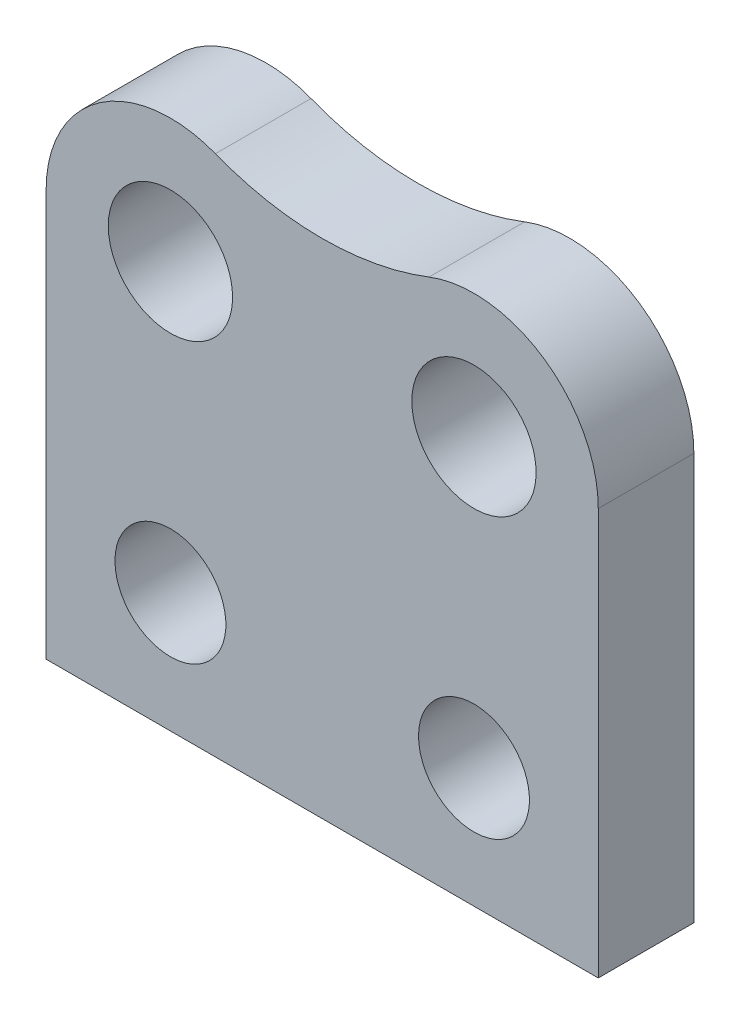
SolidWorks part; units mm, degrees
ref_plane "Front Plane" through (0, 0, 0) normal (0, 0, 1) x (1, 0, 0)
ref_plane "Top Plane" through (0, 0, 0) normal (0, 1, 0) x (1, 0, 0)
ref_plane "Right Plane" through (0, 0, 0) normal (1, 0, 0) x (0, 0, -1)
sketch "Sketch1" plane through (0, 0, 0) normal (0, 0, 1) x (1, 0, 0)
  line L0 (0, 0) -> (0, 10)
  line L1 (0, 10) -> (7.5, 10)
  line L2 (7.5, 10) -> (12.4992, 14.9992)
  line L3 (12.4992, 14.9992) -> (12.4992, 34.4)
  line L4 (12.4992, 34.4) -> (24.7492, 34.4)
  line L5 (24.7492, 34.4) -> (24.7492, 14.9992)
  line L6 (24.7492, 14.9992) -> (29.7485, 10)
  line L7 (29.7485, 10) -> (37.2485, 10)
  line L8 (37.2485, 10) -> (37.2485, 0)
  line L9 (37.2485, 0) -> (0, 0)
  dimension "D1" = 7.07
  dimension "D2" = 7.07
  dimension "D3" = 34.4
  dimension "D4" = 10
  dimension "D5" = 10
  dimension "D6" = 7.5
  dimension "D7" = 7.5
  dimension "D8" = 12.25
  dimension "D9" = 37.2485
extrude "Boss-Extrude1" add sketch "Sketch1" along normal blind 6.18
sketch "Sketch2" plane through (0, 10, 0) normal (0, 1, 0) x (1, 0, 0)
  line L2 (7.5, 0) -> (0, 0) construction
  line L5 (7.5, -6.18) -> (7.5, 0) construction
  line L6 (37.2485, 0) -> (29.7485, 0) construction
  line L7 (37.2485, -6.18) -> (37.2485, 0) construction
  circle A0 centre (3.75, -3.09) radius 2.1
  circle A1 centre (33.4985, -3.09) radius 2.1
  dimension "D1" = 4.2
  dimension "D2" = 3.09
  dimension "D3" = 3.75
  dimension "D4" = 3.09
  dimension "D5" = 3.75
extrude "Cut-Extrude1" cut sketch "Sketch2" against normal through all
fillet "Fillet1" radius 2 6 edges at (0, 5, 0) (0, 5, 6.18) (37.2485, 5, 0) (37.2485, 5, 6.18) (24.7492, 34.4, 3.09) (12.4992, 34.4, 3.09)
sketch "Sketch3" plane through (0, 0, 0) normal (0, 0, -1) x (-1, 0, 0)
  line L1 (-21.1131, 29.9595) -> (-9.5631, 29.9595)
  line L2 (-21.1131, 29.9595) -> (-21.1131, 21.4548)
  line L3 (-21.1131, 21.4548) -> (-9.5631, 21.4548)
  line L4 (-9.5631, 29.9595) -> (-9.5631, 21.4548)
  circle A1 centre (-18.5131, 23.9595) radius 1.16
  circle A2 centre (-12.1631, 23.9595) radius 1.16
  circle A4 centre (-18.5131, 29.9595) radius 1.155
  circle A5 centre (-12.1631, 29.9595) radius 1.155
  circle A6 centre (-18.5131, 29.9595) radius 2.6
  circle A7 centre (-12.1631, 29.9595) radius 2.6
  circle A8 centre (-15.3381, 38.1346) radius 6.17
  dimension "D1" = 2.32
  dimension "D2" = 6
  dimension "D3" = 6
extrude "Boss-Extrude2" add sketch "Sketch3" along normal blind 2 contours A7 L1 A6 L2 L3 A2 A1 M34 | A7 A2 L3 L4 M34 | L1 A7 A5 M34 | A7 L1 A5 M34 | L1 A7 A5 M35 M34 | A7 L1 A5 M35 M34 | L1 A6 A4 | L1 A6 A4 | A8 A6 L1 A7
sketch "Sketch5" plane through (0, 0, 6.18) normal (0, 0, 1) x (1, 0, 0)
  line L1 (-4.9802, 37.9454) -> (41.2524, 37.9454)
  line L2 (-4.9802, 37.9454) -> (-4.9802, -3.7546)
  line L3 (-4.9802, -3.7546) -> (41.2524, -3.7546)
  line L4 (41.2524, 37.9454) -> (41.2524, -3.7546)
extrude "Cut-Extrude2" cut sketch "Sketch5" against normal blind 6.18
sketch "Sketch9" plane through (0, 0, -2) normal (0, 0, -1) x (-1, 0, 0)
  circle A0 centre (-18.5131, 29.9595) radius 1.3
  circle A1 centre (-12.1631, 29.9595) radius 1.3
  dimension "D1" = 2.6
extrude "Cut-Extrude3" cut sketch "Sketch9" against normal through all
